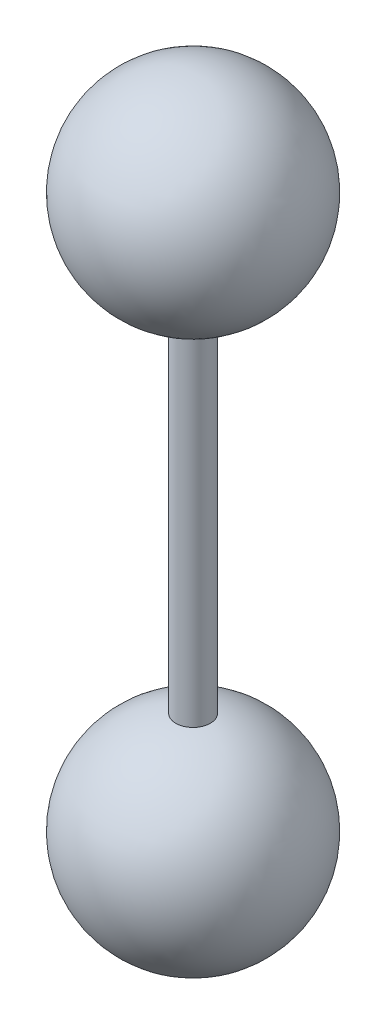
SolidWorks part; units mm, degrees
ref_plane "Front Plane" through (0, 0, 0) normal (0, 0, 1) x (1, 0, 0)
ref_plane "Top Plane" through (0, 0, 0) normal (0, 1, 0) x (1, 0, 0)
ref_plane "Right Plane" through (0, 0, 0) normal (1, 0, 0) x (0, 0, -1)
sketch "Sketch1" plane through (0, 0, 0) normal (0, 0, 1) x (1, 0, 0)
  line L0 (0, 0) -> (0.25, 0)
  line L1 (0.25, 0) -> (0.25, 2.521)
  line L3 (0, 5.5) -> (0, 0)
  line L4 (0, 0) -> (0, 5.5) construction
  line L5 (0, 4) -> (0, 24.1174) construction
  arc A0 (0.25, 2.521) -> (0, 5.5) centre (0, 4) ccw
  dimension "D2" = 3
  dimension "D3" = 4
  dimension "D1" = 0.5
revolve "Revolve1" add sketch "Sketch1" angle 360 about L3
mirror "Mirror1" about plane through (0, 0, 0) normal (0, 1, 0)
